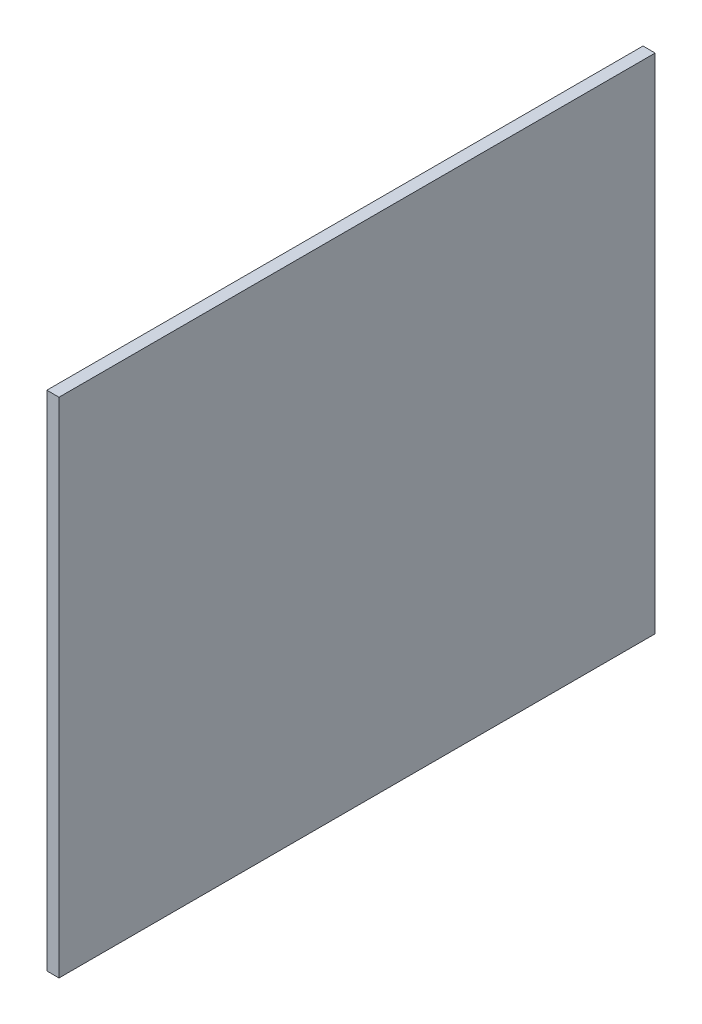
SolidWorks part; units mm, degrees
ref_plane "Front" through (0, 0, 0) normal (0, 0, 1) x (1, 0, 0)
ref_plane "Top" through (0, 0, 0) normal (0, 1, 0) x (1, 0, 0)
ref_plane "Right" through (0, 0, 0) normal (1, 0, 0) x (0, 0, -1)
sketch "Sketch1" plane through (0, 0, 0) normal (1, 0, 0) x (0, 0, -1)
  line L1 (0, 0) -> (999.998, 0)
  line L2 (0, 0) -> (0, 525.018)
  line L3 (0, 525.018) -> (999.998, 525.018)
  line L4 (999.998, 0) -> (999.998, 525.018)
  dimension "D1" = 525.018
  dimension "D2" = 999.998
extrude "Extrude1" add sketch "Sketch1" along normal blind 12.7
sketch "Sketch2" plane through (12.7, 0, 0) normal (1, 0, 0) x (0, 0, -1)
  line L0 (0, 525.018) -> (0, 0) construction
  line L1 (622.3, 590.6151) -> (1136.0135, 590.6151)
  line L2 (622.3, 590.6151) -> (622.3, -49.4313)
  line L3 (622.3, -49.4313) -> (1136.0135, -49.4313)
  line L4 (1136.0135, 590.6151) -> (1136.0135, -49.4313)
  dimension "D2" = 622.3
extrude "Cut-Extrude1" cut sketch "Sketch2" against normal through all
